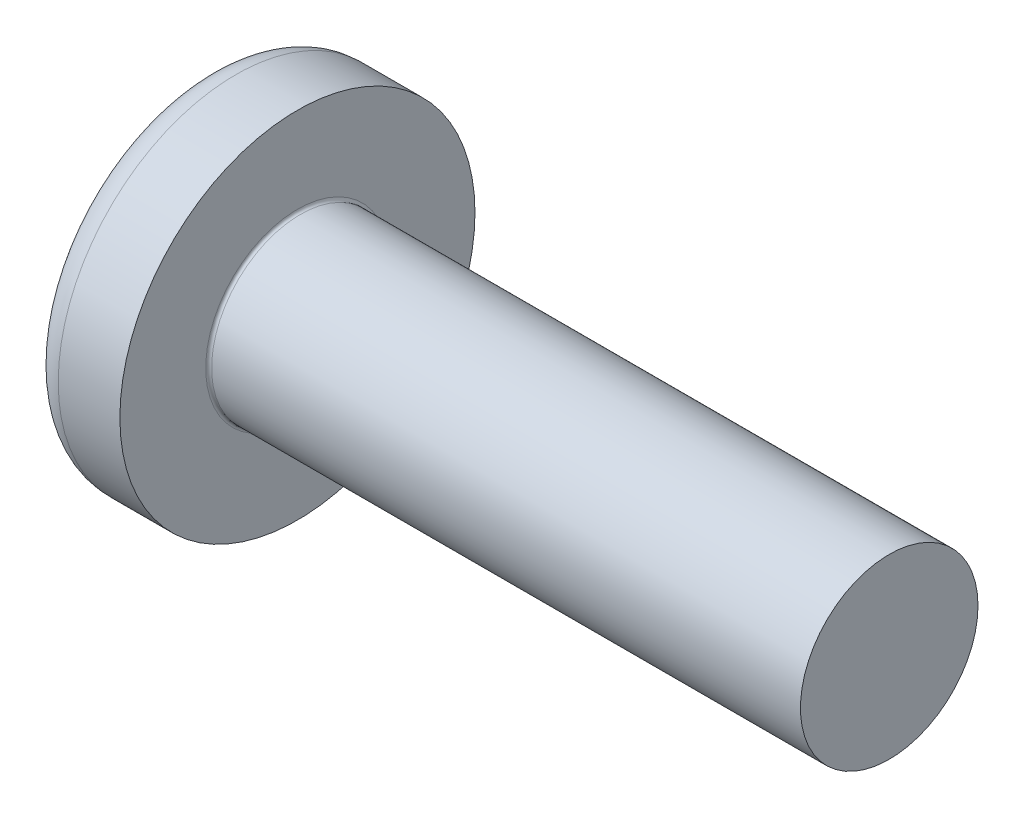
SolidWorks part; units mm, degrees
ref_plane "Front" through (0, 0, 0) normal (0, 0, 1) x (1, 0, 0)
ref_plane "Top" through (0, 0, 0) normal (0, 1, 0) x (1, 0, 0)
ref_plane "Right" through (0, 0, 0) normal (1, 0, 0) x (0, 0, -1)
sketch "Sketch1" plane through (0, 0, 0) normal (1, 0, 0) x (0, 0, -1)
  circle A0 centre (0, 0) radius 6
  dimension "dk" = 12
extrude "BaseHead" add sketch "Sketch1" along normal blind 4.6
sketch "Sketch2" plane through (4.6, 0, 0) normal (1, 0, 0) x (0, 0, -1)
  circle A0 centre (0, 0) radius 3
extrude "BaseBody" add sketch "Sketch2" along normal blind 20
fillet "Fillet1" radius 0.1 1 edges at (4.6, 0, -3)
sketch "Sketch3" plane through (-4.0827, -1.9173, 0) normal (0, 0, 1) x (0, -1, 0)
  line L0 (-1.9173, 6.3195) -> (-1.9173, 20.448) construction
  line L3 (-7.9173, 4.0827) -> (-1.9173, 4.0827) construction
  line L5 (-7.9173, 6.0827) -> (-7.9173, -0.9173)
  line L6 (-1.9173, 4.0827) -> (-1.9173, -0.9173)
  line L7 (-1.9173, -0.9173) -> (-7.9173, -0.9173)
  line L8 (-7.9173, 8.6827) -> (-7.9173, 4.0827) construction
  arc A0 (-7.9173, 6.0827) -> (-1.9173, 4.0827) centre (-1.9173, 14.0827) ccw
  dimension "r1" = 10
  dimension "D2" = 5
revolve "BaseTop" cut sketch "Sketch3" angle 360 about L0
sketch "Sketch4" plane through (0, 0, 0) normal (1, 0, 0) x (0, 0, -1)
  line L1 (2.396, 0) -> (1.198, 2.075)
  line L2 (1.198, 2.075) -> (-1.198, 2.075)
  line L3 (-1.198, 2.075) -> (-2.396, 0)
  line L4 (-2.396, 0) -> (-1.198, -2.075)
  line L5 (-1.198, -2.075) -> (1.198, -2.075)
  line L6 (1.198, -2.075) -> (2.396, 0)
  circle A0 centre (0, 0) radius 2.075 construction
  dimension "B" = 4.15
extrude "Socket" cut sketch "Sketch4" along normal blind 2
sketch "Sketch5" plane through (2, 0, 0) normal (-1, 0, 0) x (0, 0, 1)
  line L0 (2.396, 0) -> (1.198, -2.075) construction
  line L1 (1.198, 2.075) -> (2.396, 0) construction
  line L2 (1.198, -2.075) -> (-1.198, -2.075) construction
  line L3 (-1.198, -2.075) -> (-2.396, 0) construction
  line L4 (-1.198, 2.075) -> (1.198, 2.075) construction
  line L5 (-2.396, 0) -> (-1.198, 2.075) construction
  line L6 (2.396, 0) -> (1.198, -2.075)
  line L7 (1.198, 2.075) -> (2.396, 0)
  line L8 (1.198, -2.075) -> (-1.198, -2.075)
  line L9 (-1.198, -2.075) -> (-2.396, 0)
  line L10 (-1.198, 2.075) -> (1.198, 2.075)
  line L11 (-2.396, 0) -> (-1.198, 2.075)
extrude "Cut-Extrude2" cut sketch "Sketch5" against normal blind 5 draft 60
sketch "Sketch6" plane through (-30.7487, 13.2487, 0) normal (0, 0, 1) x (0, -1, 0)
  line L0 (13.2487, 89.8637) -> (13.2487, 24.8312) construction
  line L1 (-4.2513, 35.3487) -> (10.6487, 35.3487)
  line L2 (-4.2513, 35.3487) -> (-4.2513, 45.3487)
  line L3 (-4.2513, 45.3487) -> (10.2487, 45.3487)
  line L4 (10.7487, 35.4487) -> (10.7487, 43.3487)
  line L5 (10.6487, 35.3487) -> (10.7487, 35.3487)
  line L6 (10.2487, 45.3487) -> (10.7487, 43.3487)
  line L7 (10.7487, 35.4487) -> (10.7487, 35.3487)
  line L8 (16.2487, 55.3487) -> (10.2487, 55.3487) construction
  line L9 (19.2487, 35.3487) -> (7.2487, 35.3487) construction
  arc A0 (10.6487, 35.3487) -> (10.7487, 35.4487) centre (10.6487, 35.4487) ccw construction
  dimension "d1" = 5
  dimension "D2" = 15
  dimension "b" = 10
  dimension "x" = 2
fillet "HeadFillet2" radius 1 1 edges at (2, 0, 6)
sketch "Sketch8" plane through (0, 0, 0) normal (0, 0, 1) x (1, 0, 0)
  line L0 (24.6, 2.567) -> (24.85, 3)
  line L1 (24.85, 3) -> (24.85, 3.5)
  line L2 (24.85, 3.5) -> (24.35, 3.5)
  line L3 (24.35, 3.5) -> (24.35, 3)
  line L4 (24.35, 3) -> (24.6, 2.567)
  line L5 (24.6, -3) -> (24.6, 3) construction
  line L6 (0, 0) -> (27.6816, 0) construction
  dimension "D1" = 0.5
  dimension "D2" = 6
revolve "Cut-Revolve10" [suppressed] cut sketch "Sketch8" angle 360 about L6
pattern_linear "LPattern10" [suppressed] count 30 spacing 0.6 along (1, 0, 0)
equation "\"D2@Sketch8\" = \"d@Sketch2\""
equation "\"D1@Sketch8\" =  ( \"d@Sketch2\" - \"THD_MINOR@ThreadCosmetic1\" )  / 2"
equation "\"D3@LPattern10\" = \"D1@Sketch8\" * 1.2"
equation "\"D1@LPattern10\" = \"D1@ThreadCosmetic1\" / \"D3@LPattern10\" "
